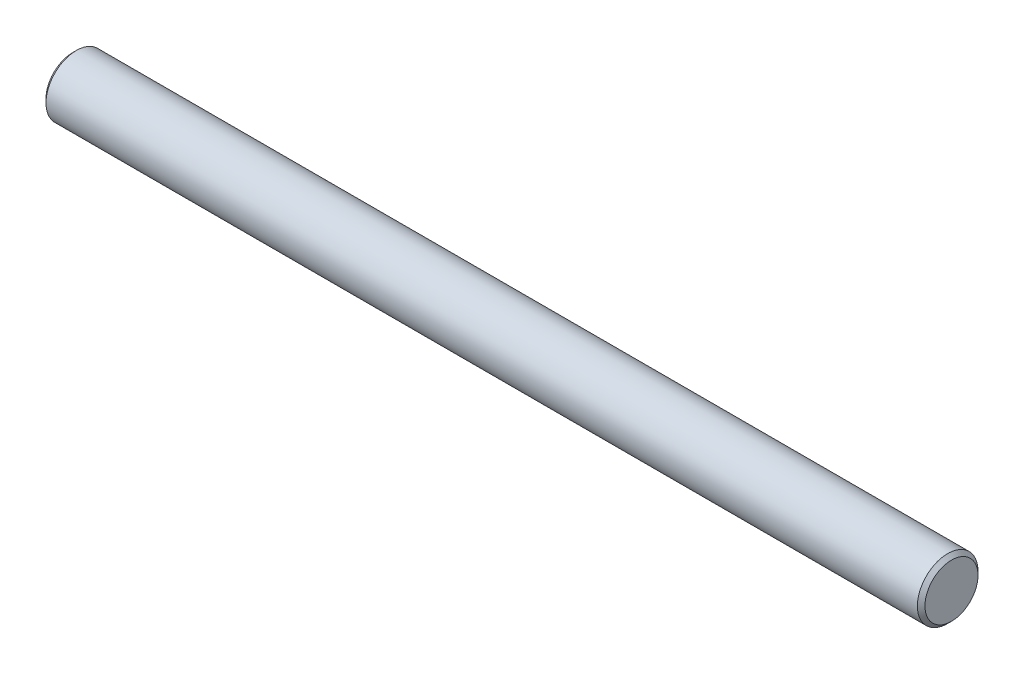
SolidWorks part; units mm, degrees
ref_plane "Front" through (0, 0, 0) normal (0, 0, 1) x (1, 0, 0)
ref_plane "Top" through (0, 0, 0) normal (0, 1, 0) x (1, 0, 0)
ref_plane "Right" through (0, 0, 0) normal (1, 0, 0) x (0, 0, -1)
sketch "Sketch1" plane through (0, 0, 0) normal (1, 0, 0) x (0, 0, -1)
  circle A0 centre (0, 0) radius 8
  dimension "D1" = 16
extrude "Extrude1" add sketch "Sketch1" along normal blind 232
chamfer "Chamfer1" distance 1 angle 45 2 edges at (0, 0, -8) (232, 0, -8)
